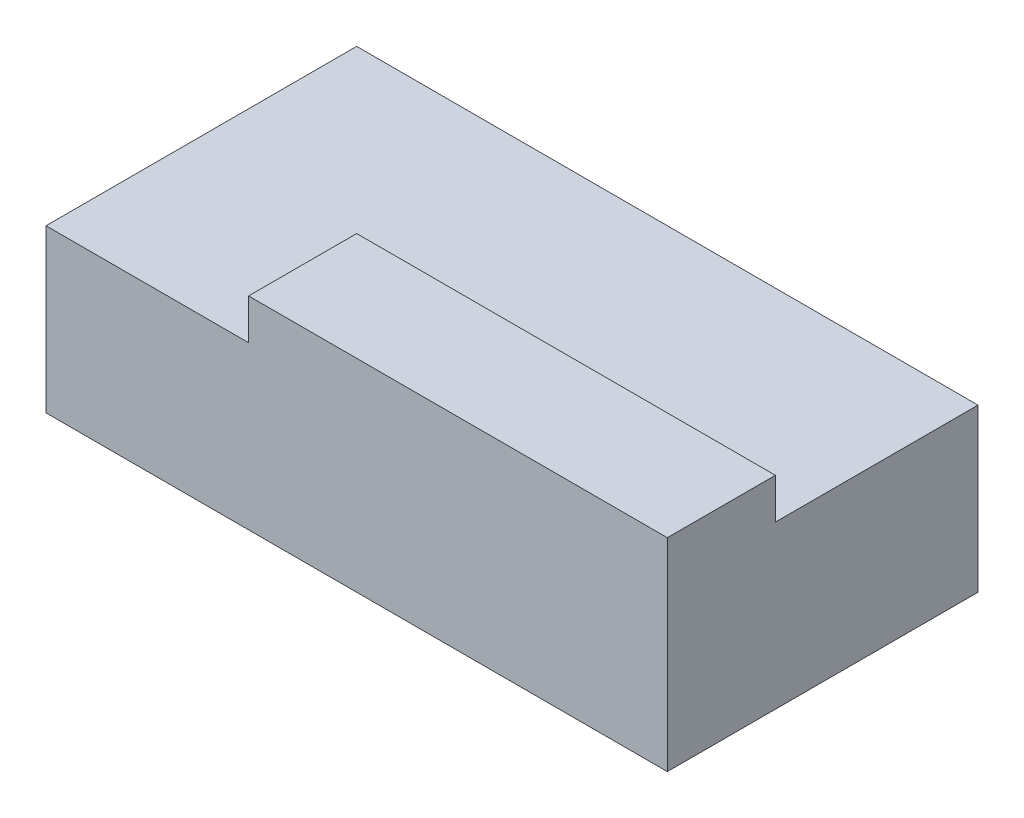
SolidWorks part; units mm, degrees
ref_plane "Front Plane" through (0, 0, 0) normal (0, 0, 1) x (1, 0, 0)
ref_plane "Top Plane" through (0, 0, 0) normal (0, 1, 0) x (1, 0, 0)
ref_plane "Right Plane" through (0, 0, 0) normal (1, 0, 0) x (0, 0, -1)
sketch "Sketch1" plane through (0, 0, 0) normal (0, 1, 0) x (1, 0, 0)
  line L1 (-115, 57.5) -> (115, 57.5)
  line L2 (-115, 57.5) -> (-115, -57.5)
  line L3 (-115, -57.5) -> (115, -57.5)
  line L4 (115, 57.5) -> (115, -57.5)
  line L5 (-115, 57.5) -> (115, -57.5) construction
  line L6 (-115, -57.5) -> (115, 57.5) construction
  point P0 (0, 0)
  dimension "D1" = 230
  dimension "D2" = 115
extrude "Boss-Extrude1" add sketch "Sketch1" along normal mid plane 75
sketch "Sketch2" plane through (0, 37.5, 0) normal (0, 1, 0) x (1, 0, 0)
  line L0 (-115, -57.5) -> (115, -57.5) construction
  line L1 (-115, 57.5) -> (-40, 57.5)
  line L2 (-115, 57.5) -> (-115, -57.5)
  line L3 (-115, -57.5) -> (-40, -57.5)
  line L4 (-40, 57.5) -> (-40, -57.5)
  dimension "D1" = 75
extrude "Cut-Extrude1" cut sketch "Sketch2" against normal blind 15
sketch "Sketch4" plane through (0, 37.5, 0) normal (0, 1, 0) x (1, 0, 0)
  line L0 (115, -57.5) -> (115, 57.5) construction
  line L1 (-40, 57.5) -> (115, 57.5)
  line L2 (-40, 57.5) -> (-40, -17.5)
  line L3 (-40, -17.5) -> (115, -17.5)
  line L4 (115, 57.5) -> (115, -17.5)
  dimension "D1" = 75
extrude "Cut-Extrude3" cut sketch "Sketch4" against normal blind 15
